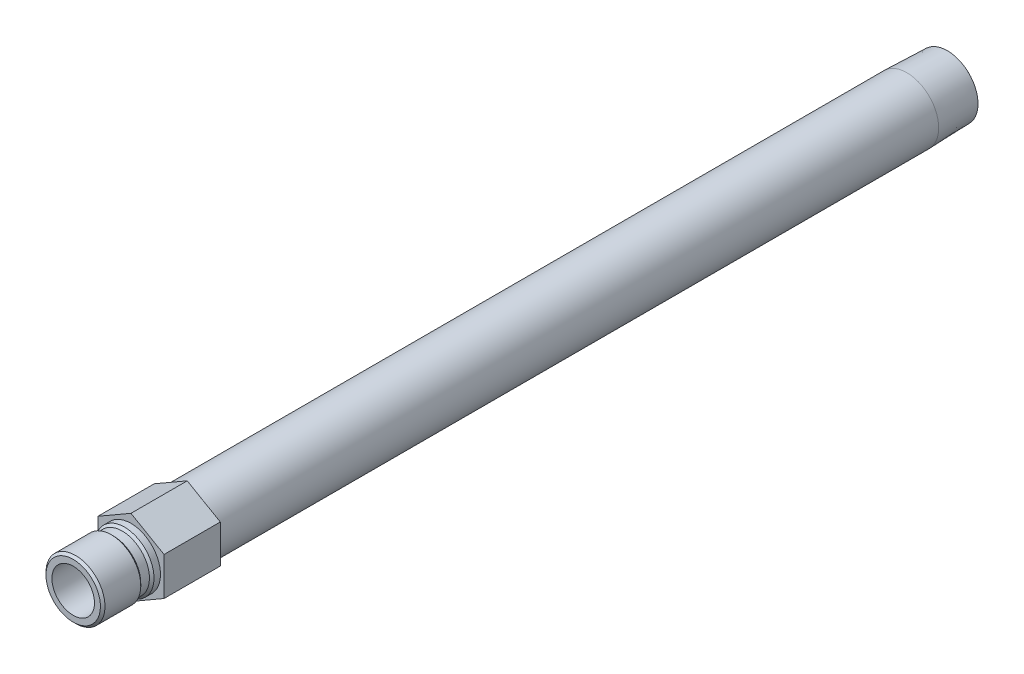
SolidWorks part; units mm, degrees
ref_plane "Front Plane" through (0, 0, 0) normal (0, 0, 1) x (1, 0, 0)
ref_plane "Top Plane" through (0, 0, 0) normal (0, 1, 0) x (1, 0, 0)
ref_plane "Right Plane" through (0, 0, 0) normal (1, 0, 0) x (0, 0, -1)
sketch "Sketch1" plane through (0, 0, 0) normal (1, 0, 0) x (0, 0, -1)
  line L0 (0, 0) -> (-22.479, 0) construction
  line L1 (-19.304, 7.112) -> (-19.304, 9.0932)
  line L2 (-5.8166, 9.0932) -> (-5.8166, 0) construction
  line L3 (-18.542, 9.8552) -> (-6.5786, 9.8552)
  line L4 (0, 10.668) -> (0, 0) construction
  line L5 (-5.8166, 9.0932) -> (-2.921, 9.0932)
  line L6 (-2.159, 9.8552) -> (0, 9.8552)
  line L7 (0, 9.8552) -> (0, 10.668)
  line L8 (-5.8166, 9.0932) -> (-6.5786, 9.8552)
  line L9 (-2.921, 9.0932) -> (-2.159, 9.8552)
  line L10 (-19.304, 9.0932) -> (-18.542, 9.8552)
  line L11 (-19.304, 7.112) -> (-1.524, 7.112)
  line L12 (0, 10.668) -> (259.2324, 10.668)
  line L13 (259.2324, 10.668) -> (272.796, 10.2441)
  line L14 (272.796, 10.2441) -> (272.796, 7.8994)
  line L15 (0, 9.8552) -> (18.796, 9.8552) construction
  line L16 (18.796, 9.8552) -> (18.796, 0) construction
  line L17 (18.796, 0) -> (0, 0) construction
  line L18 (-1.524, 7.112) -> (-1.1053, 7.8994)
  line L19 (-1.1053, 7.8994) -> (272.796, 7.8994)
  dimension "D1" = 19.304
  dimension "D2" = 2.8956
  dimension "D3" = 0.762
  dimension "D4" = 45
  dimension "D5" = 13.4874
  dimension "D6" = 45
  dimension "D7" = 1.79
  dimension "D8" = 13.5636
  dimension "D9" = 292.1
  dimension "D10" = 3.175
  dimension "D11" = 38.1
  dimension "D12" = 14.224
  dimension "D13" = 21.336
  dimension "D14" = 19.7104
  dimension "D15" = 15.7988
  dimension "D16" = 118
  dimension "D17" = 17.78
revolve "Revolve1" add sketch "Sketch1" angle 360 about L0
sketch "Sketch2" plane through (0, 0, 0) normal (0, 0, 1) x (1, 0, 0)
  line L1 (-11.049, 6.3791) -> (-11.049, -6.3791)
  line L2 (-11.049, -6.3791) -> (0, -12.7583)
  line L3 (0, -12.7583) -> (11.049, -6.3791)
  line L4 (11.049, -6.3791) -> (11.049, 6.3791)
  line L5 (11.049, 6.3791) -> (0, 12.7583)
  line L6 (0, 12.7583) -> (-11.049, 6.3791)
  circle A0 centre (0, 0) radius 11.049 construction
  circle A1 centre (0, 0) radius 7.112 construction
  circle A2 centre (0, 0) radius 7.112
  dimension "D1" = 22.098
extrude "Boss-Extrude1" add sketch "Sketch2" against normal up to vertex (18.796 mm away) from vertex at 0
